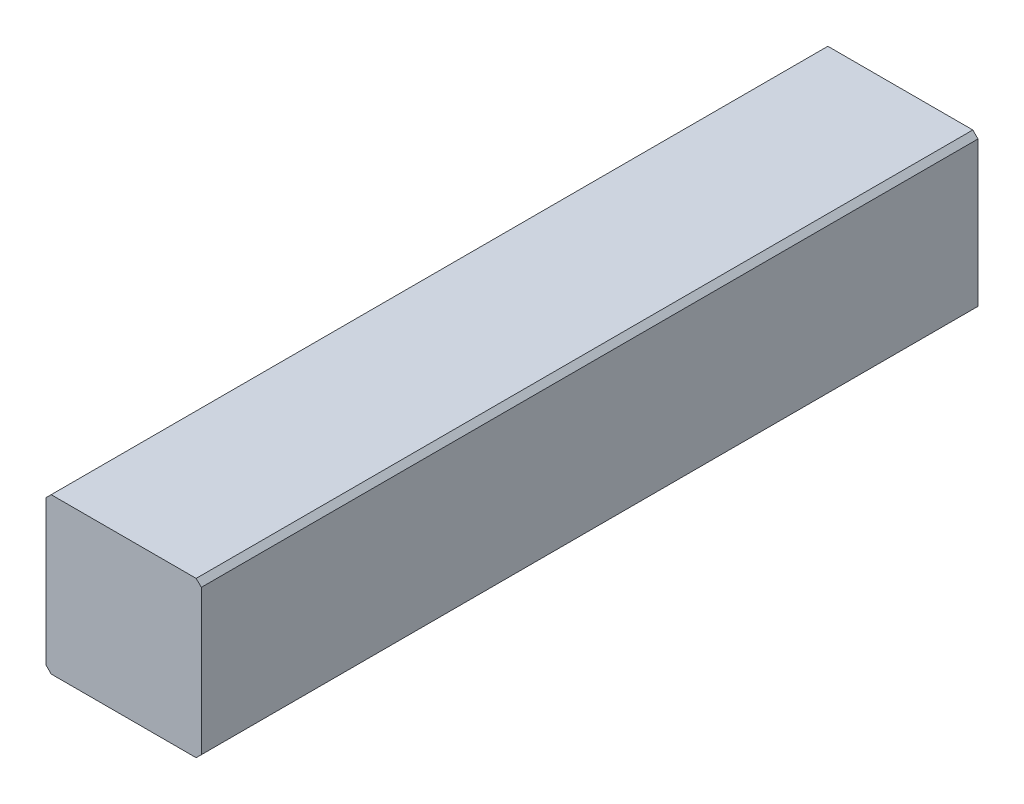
SolidWorks part; units mm, degrees
ref_plane "Face" through (0, 0, 0) normal (0, 0, 1) x (1, 0, 0)
ref_plane "Dessus" through (0, 0, 0) normal (0, 1, 0) x (1, 0, 0)
ref_plane "Droite" through (0, 0, 0) normal (1, 0, 0) x (0, 0, -1)
sketch "Esquisse1" plane through (0, 0, 0) normal (0, 0, 1) x (1, 0, 0)
  line L0 (-3, -3) -> (3, 3) construction
  line L1 (-3, -3) -> (3, -3)
  line L2 (-3, -3) -> (-3, 3)
  line L3 (-3, 3) -> (3, 3)
  line L4 (3, -3) -> (3, 3)
  dimension "D1" = 6
extrude "Extrusion1" add sketch "Esquisse1" along normal mid plane 30
chamfer "Chanfrein1" distance 0.2 angle 45 4 edges at (-3, -3, 0) (3, -3, 0) (-3, 3, 0) (3, 3, 0)
